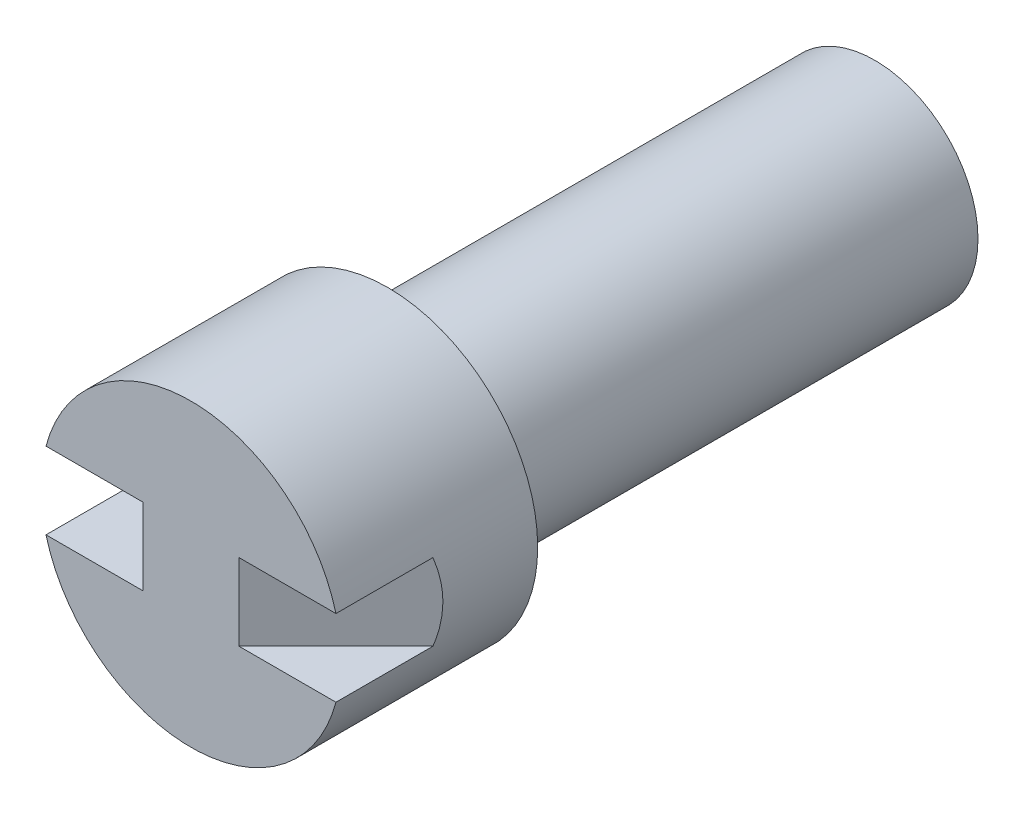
SolidWorks part; units mm, degrees
ref_plane "Спереди" through (0, 0, 0) normal (0, 0, 1) x (1, 0, 0)
ref_plane "Сверху" through (0, 0, 0) normal (0, 1, 0) x (1, 0, 0)
ref_plane "Справа" through (0, 0, 0) normal (1, 0, 0) x (0, 0, -1)
sketch "Эскиз1" plane through (0, 0, 0) normal (1, 0, 0) x (0, 0, -1)
  line L0 (0, 0) -> (22.4881, 0) construction
  line L1 (0, 0) -> (0, 1.5875)
  line L2 (0, 1.5875) -> (2.0828, 1.5875)
  line L3 (2.0828, 1.5875) -> (2.0828, 1.0922)
  line L4 (2.0828, 1.0922) -> (7.239, 1.0922)
  line L5 (7.239, 1.0922) -> (7.239, 0)
  line L6 (7.239, 0) -> (0, 0)
  dimension "D1" = 7.239
  dimension "D2" = 5.1562
  dimension "D3" = 3.175
  dimension "D4" = 2.1844
revolve "Повернуть1" add sketch "Эскиз1" angle 360 about L0
sketch "Эскиз2" plane through (0, 0, 0) normal (0, 1, 0) x (1, 0, 0)
  line L0 (-0.508, 0) -> (-1.5875, 1.0795)
  line L1 (-1.5875, 1.0795) -> (-1.5875, 0)
  line L2 (-1.5875, 2.0828) -> (-1.5875, 0) construction
  line L3 (-1.5875, 0) -> (-0.508, 0)
  line L4 (0.508, 0) -> (1.5875, 0)
  line L5 (1.5875, 0) -> (1.5875, 1.0795)
  line L6 (1.5875, 0) -> (1.5875, 2.0828) construction
  line L7 (1.5875, 1.0795) -> (0.508, 0)
  line L8 (-1.5875, 0) -> (1.5875, 0) construction
  dimension "D1" = 45
  dimension "D2" = 45
  dimension "D3" = 1.016
extrude "Вырез-Вытянуть1" cut sketch "Эскиз2" against normal mid plane 0.8128
